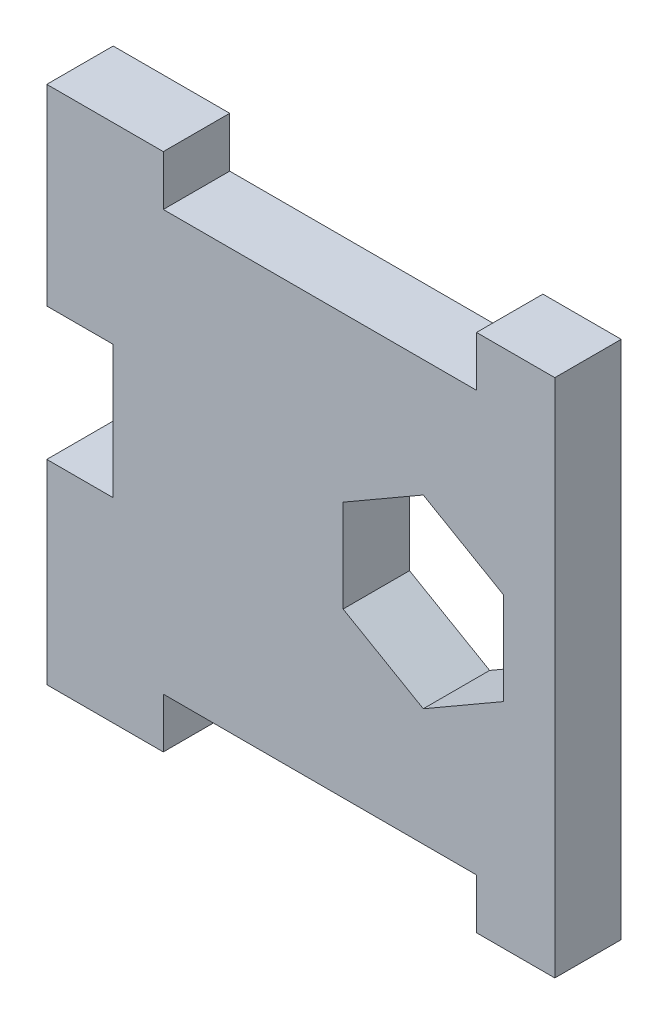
SolidWorks part; units mm, degrees
ref_plane "Front Plane" through (0, 0, 0) normal (0, 0, 1) x (1, 0, 0)
ref_plane "Top Plane" through (0, 0, 0) normal (0, 1, 0) x (1, 0, 0)
ref_plane "Right Plane" through (0, 0, 0) normal (1, 0, 0) x (0, 0, -1)
sketch "Sketch2" plane through (0, 0, -7.1974) normal (0, 0, 1) x (1, 0, 0)
  line L0 (635.4991, -721.9733) -> (635.4991, -714.4678)
  line L1 (635.4991, -714.4678) -> (628.9991, -710.715)
  line L2 (628.9991, -710.715) -> (622.4991, -714.4678)
  line L3 (622.4991, -714.4678) -> (622.4991, -721.9733)
  line L4 (622.4991, -721.9733) -> (628.9991, -725.7261)
  line L5 (628.9991, -725.7261) -> (635.4991, -721.9733)
  line L6 (607.9171, -735.2385) -> (633.3171, -735.2385)
  line L7 (633.3171, -735.2385) -> (633.3171, -739.3025)
  line L8 (598.4683, -723.4783) -> (598.4683, -739.3025)
  line L9 (598.4683, -739.3025) -> (607.9171, -739.3025)
  line L10 (633.3171, -739.3025) -> (639.6671, -739.3025)
  line L11 (603.8531, -712.7087) -> (598.4683, -712.7087)
  line L12 (639.6671, -739.3025) -> (639.6671, -697.1385)
  line L13 (633.3171, -697.1385) -> (633.3171, -701.2025)
  line L14 (603.8531, -718.0935) -> (603.8531, -712.7087)
  line L15 (639.6671, -697.1385) -> (633.3171, -697.1385)
  line L16 (603.8531, -718.0935) -> (603.8531, -723.4783)
  line L17 (633.3171, -701.2025) -> (607.9171, -701.2025)
  line L18 (607.9171, -701.2025) -> (607.9171, -697.1385)
  line L20 (603.8531, -723.4783) -> (598.4683, -723.4783)
  line L21 (598.4683, -712.7087) -> (598.4683, -697.1385)
  line L22 (598.4683, -697.1385) -> (607.9171, -697.1385)
  line L23 (607.9171, -739.3025) -> (607.9171, -735.2385)
  dimension "D1" = 42.164
  dimension "D2" = 4.064
  dimension "D3" = 4.064
  dimension "D5" = 5.3848
  dimension "D7" = 4.064
  dimension "D8" = 5.3848
extrude "Boss-Extrude1" add sketch "Sketch2" along normal blind 5.3848 contours L9 L23 L6 L7 L10 L12 L15 L13 L17 L18 L22 L21 L11 L14 L16 L20 L8 L5 L4 L3 L2 L1 L0
